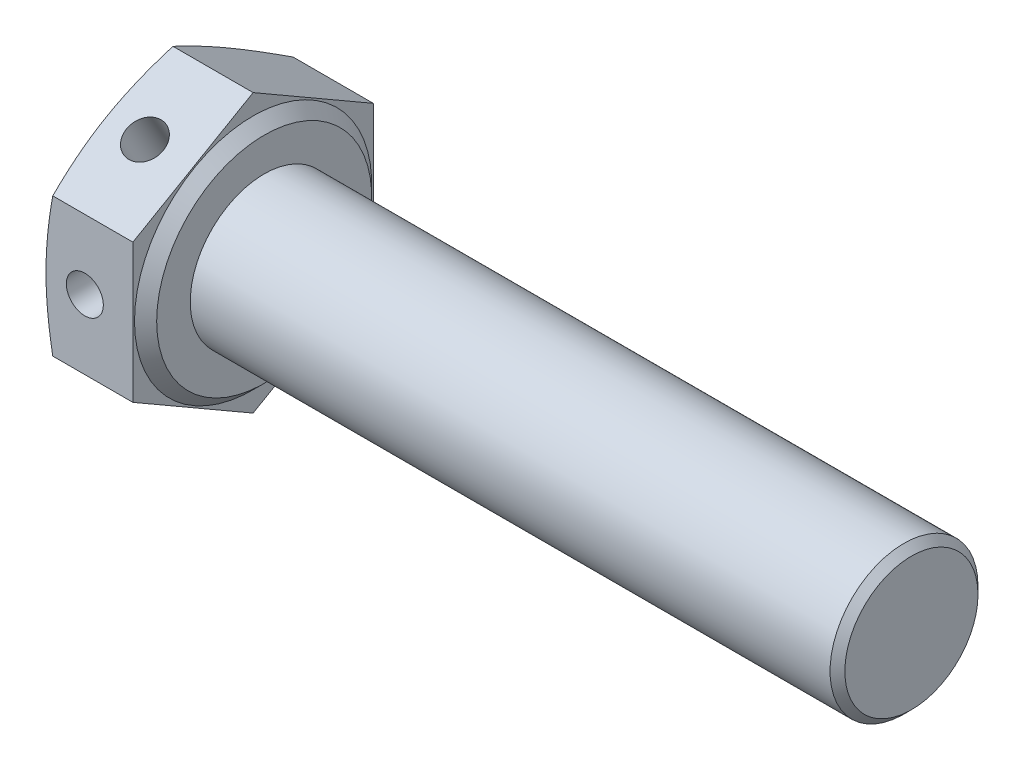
SolidWorks part; units mm, degrees
ref_plane "Front" through (0, 0, 0) normal (0, 0, 1) x (1, 0, 0)
ref_plane "Top" through (0, 0, 0) normal (0, 1, 0) x (1, 0, 0)
ref_plane "Right" through (0, 0, 0) normal (1, 0, 0) x (0, 0, -1)
sketch "Sketch2" plane through (0, 0, 0) normal (1, 0, 0) x (0, 0, -1)
  line L1 (0, -7.5056) -> (6.5, -3.7528)
  line L2 (6.5, -3.7528) -> (6.5, 3.7528)
  line L3 (6.5, 3.7528) -> (0, 7.5056)
  line L4 (0, 7.5056) -> (-6.5, 3.7528)
  line L5 (-6.5, 3.7528) -> (-6.5, -3.7528)
  line L6 (-6.5, -3.7528) -> (0, -7.5056)
  circle A0 centre (0, 0) radius 6.5 construction
  dimension "s" = 13
extrude "BaseHead" add sketch "Sketch2" along normal blind 5.3
sketch "Sketch3" plane through (0, 0, 0) normal (0, 0, 1) x (1, 0, 0)
  line L0 (5.3, 7.5056) -> (5.3, 5.815)
  line L2 (5.3, 5.815) -> (4.7, 6.415)
  line L3 (4.7, 6.415) -> (4.7, 7.5056)
  line L5 (4.7, 7.5056) -> (5.3, 7.5056)
  line L6 (-0.9571, 0) -> (7.6478, 0) construction
  line L7 (5.3, 7.5056) -> (0, 7.5056) construction
  dimension "D1" = 45
  dimension "c" = 0.6
  dimension "dw" = 11.63
revolve "BearingFace" cut sketch "Sketch3" angle 360 about L6
sketch "Sketch4" plane through (0, 0, 0) normal (0, 0, 1) x (1, 0, 0)
  line L0 (-0.4935, 0) -> (3.5626, 0) construction
  line L2 (0, 7.5056) -> (0.366, 7.5056)
  line L4 (0.366, 7.5056) -> (0, 6.5)
  line L6 (0, 6.5) -> (0, 7.5056)
  line L7 (4.7, 7.5056) -> (0, 7.5056) construction
  dimension "D1" = 20
  dimension "D2" = 13
revolve "HeadChamfer" cut sketch "Sketch4" angle 360 about L0
ref_plane "Plane1" through (23.3, 0, 0) normal (1, 0, 0) x (0, 0, -1)
sketch "Sketch5" plane through (5.3, 0, 0) normal (1, 0, 0) x (0, 0, -1)
  circle A0 centre (0, 0) radius 4
  dimension "d" = 8
extrude "BaseBody" add sketch "Sketch5" along normal blind 35
chamfer "Chamfer1" distance 0.4 angle 45 1 edges at (40.3, 0, -4)
sketch "Sketch6" plane through (0, 0, 0) normal (0, 0, 1) x (1, 0, 0)
  line L2 (4.7, 3.7528) -> (4.7, -3.7528) construction
  line L3 (39.9, 0) -> (5.3, 0) construction
  circle A0 centre (2.1, 0) radius 1
  dimension "d1" = 2
  dimension "h" = 2.6
extrude "Hole" cut sketch "Sketch6" against normal through all and the other way through all
pattern_circular "CirPattern1" count 2 over 60 about axis through (40.3, 0, 0) along (-1, 0, 0) of "Hole"
fillet "HeadFillet" [suppressed] radius 0.4
sketch "Sketch7" plane through (0, 0, 0) normal (0, 0, 1) x (1, 0, 0)
  line L0 (39.359, 4.2) -> (39.899, 4.2)
  line L1 (39.899, 4.2) -> (39.899, 4)
  line L2 (39.899, 4) -> (39.629, 3.5323)
  line L3 (39.359, 4) -> (39.629, 3.5323)
  line L4 (39.359, 4.2) -> (39.359, 4)
  line L5 (41.2163, 0) -> (0, 0) construction
  line L6 (39.359, 4) -> (39.899, 4) construction
  line L7 (39.629, 4) -> (39.629, 3.5323) construction
  line L8 (39.9, 4) -> (5.3, 4) construction
  point P5 (39.629, 4.2)
  dimension "D1" = 0.2
  dimension "D2" = 0.54
  dimension "D3" = 0.001
revolve "Cut-Revolve10" [suppressed] cut sketch "Sketch7" angle 360 about L5
pattern_linear "LPattern10" [suppressed] count 26 spacing 0.648
equation "\"D2@Sketch4\" = \"s@Sketch2\""
equation "\"b@ThreadCosmetic1\" = \"l@BaseBody\" - \"lg@Plane1\""
equation "\"D1@Chamfer1\" = 0.05 * \"d@Sketch5\""
equation "\"D3@LPattern10\" = \"D2@Sketch7\" * 1.2"
equation "\"D1@LPattern10\" = \"b@ThreadCosmetic1\" / \"D3@LPattern10\""
